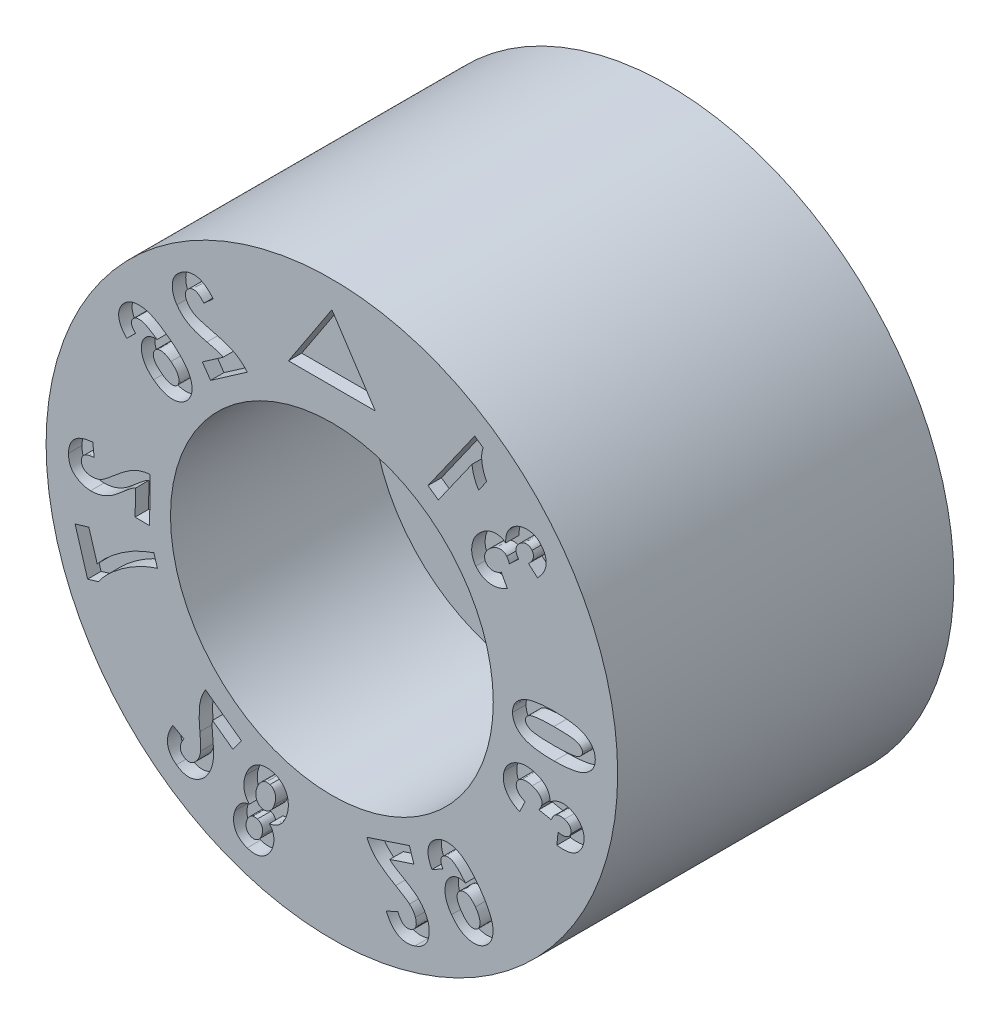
SolidWorks part; units mm, degrees
ref_plane "Front Plane" through (0, 0, 0) normal (0, 0, 1) x (1, 0, 0)
ref_plane "Top Plane" through (0, 0, 0) normal (0, 1, 0) x (1, 0, 0)
ref_plane "Right Plane" through (0, 0, 0) normal (1, 0, 0) x (0, 0, -1)
imported_body "Imported1"
other "Move Face1" parameters "D1"=0.18
other "DeleteFace1"
sketch "Sketch1" plane through (0, 0, 0) normal (0, 0, 1) x (1, 0, 0)
  arc A1 (-1.2291, 2.4419) -> (0, 2.7338) centre (0, 0) ccw construction
  text T0 "26  27  28  29  30  31" font "Arial Narrow" height 1.2
extrude "Cut-Extrude1" cut sketch "Sketch1" against normal blind 0.2
